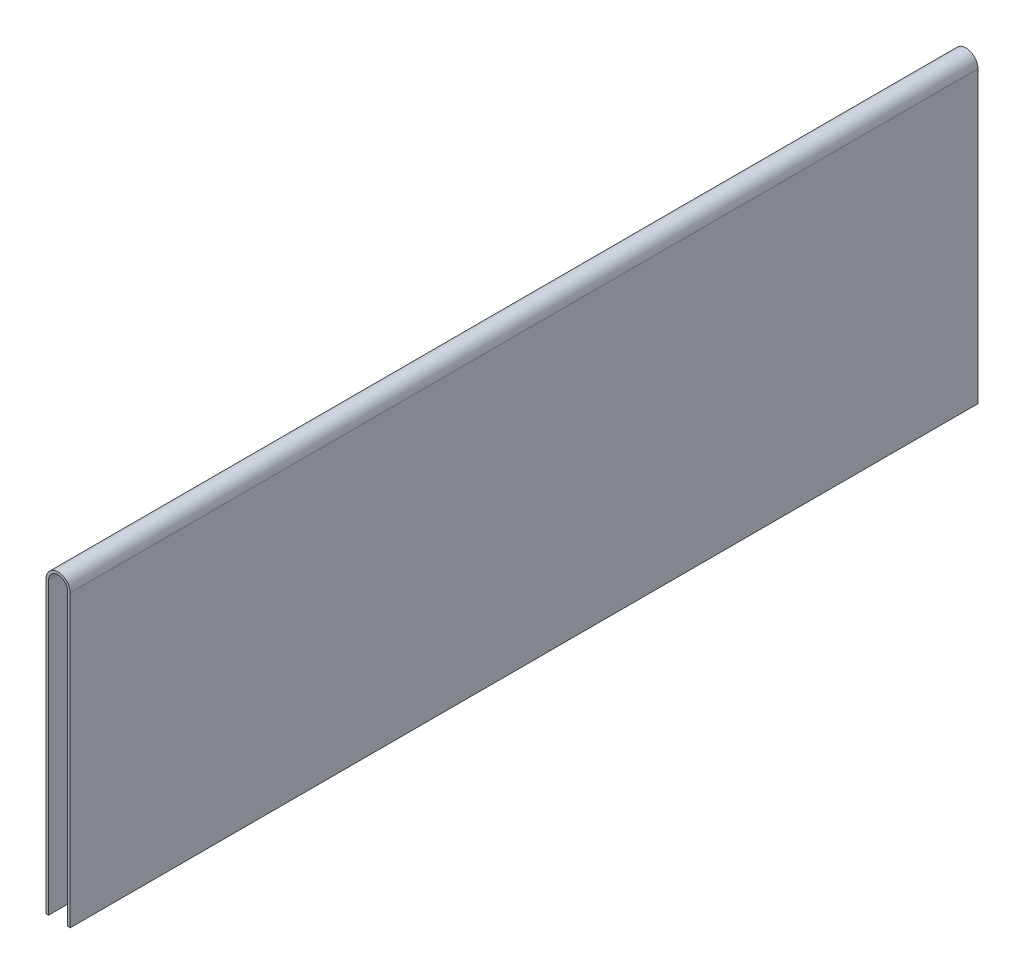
SolidWorks part; units mm, degrees
ref_plane "Front Plane" through (0, 0, 0) normal (0, 0, 1) x (1, 0, 0)
ref_plane "Top Plane" through (0, 0, 0) normal (0, 1, 0) x (1, 0, 0)
ref_plane "Right Plane" through (0, 0, 0) normal (1, 0, 0) x (0, 0, -1)
sketch "Sketch1" plane through (0, 0, 0) normal (0, 0, 1) x (1, 0, 0)
  line L0 (9.652, 0) -> (9.652, -292.1)
  line L1 (-9.652, 0) -> (-9.652, -292.1)
  arc A0 (9.652, 0) -> (-9.652, 0) centre (0, 0) ccw
  dimension "D2" = 9.652
  dimension "D1" = 292.1
  dimension "D3" = 292.1
extrude "Extrude-Thin1" add sketch "Sketch1" along normal blind 914.4 thin
